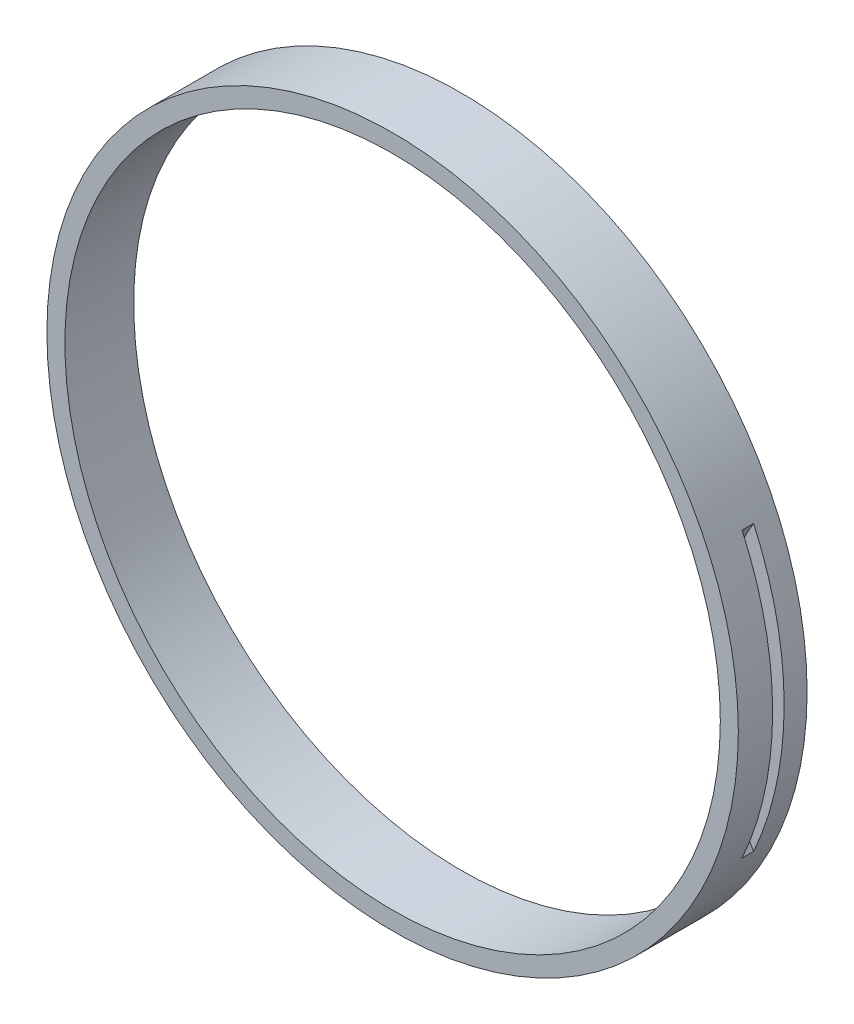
SolidWorks part; units mm, degrees
ref_plane "Спереди" through (0, 0, 0) normal (0, 0, 1) x (1, 0, 0)
ref_plane "Сверху" through (0, 0, 0) normal (0, 1, 0) x (1, 0, 0)
ref_plane "Справа" through (0, 0, 0) normal (1, 0, 0) x (0, 0, -1)
sketch "Эскиз1" plane through (0, 0, 0) normal (0, 0, 1) x (1, 0, 0)
  circle A0 centre (0, 0) radius 23.876
  circle A1 centre (0, 0) radius 22.6314
  dimension "D1" = 45.2628
  dimension "D2" = 47.752
extrude "Бобышка-Вытянуть1" add sketch "Эскиз1" along normal blind 4.7498
sketch "Эскиз3" plane through (0, 0, 0) normal (0, 0, -1) x (-1, 0, 0)
  circle A0 centre (-38.1, 0) radius 19.05
  dimension "D1" = 38.1
  dimension "D2" = 38.1
extrude "Вырез-Вытянуть2" cut sketch "Эскиз3" against normal blind 0.7937 from offset 1.5875
